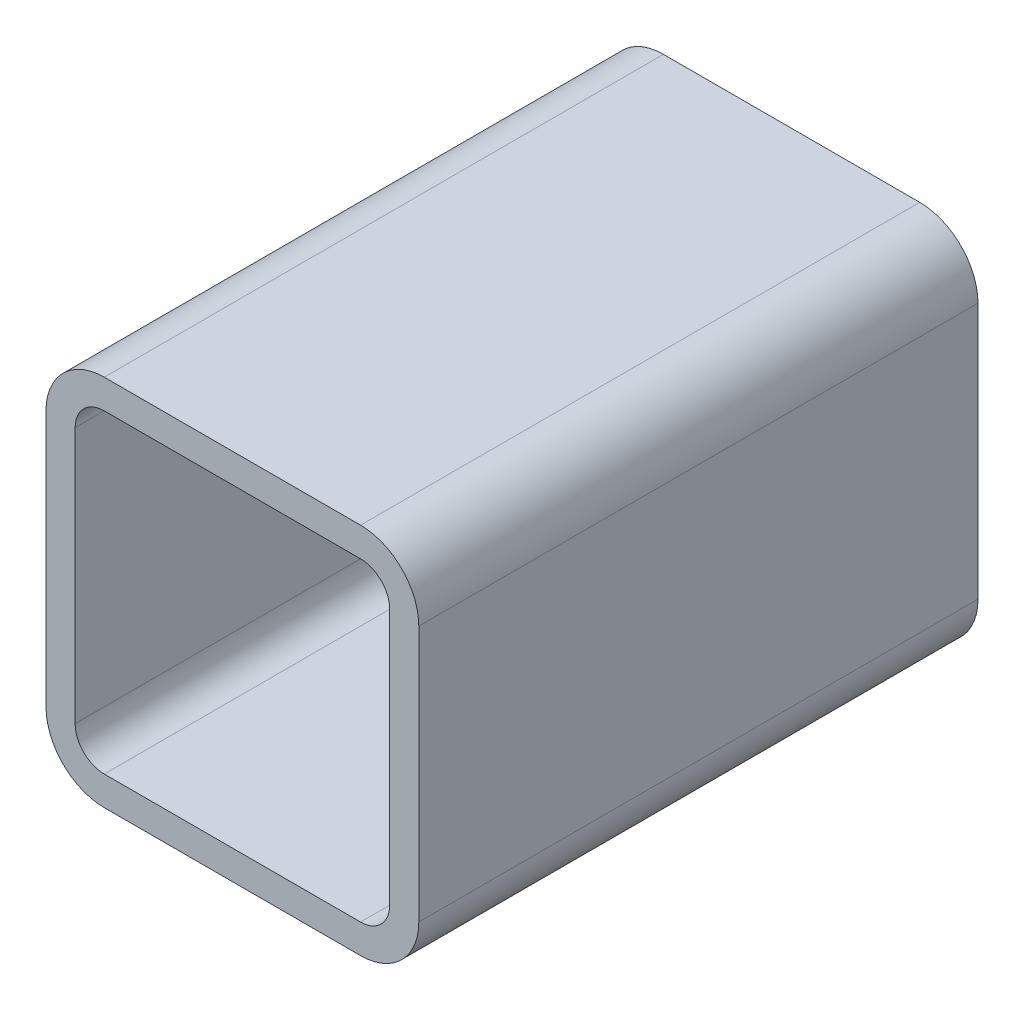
SolidWorks part; units mm, degrees
ref_plane "Front Plane" through (0, 0, 0) normal (0, 0, 1) x (1, 0, 0)
ref_plane "Top Plane" through (0, 0, 0) normal (0, 1, 0) x (1, 0, 0)
ref_plane "Right Plane" through (0, 0, 0) normal (1, 0, 0) x (0, 0, -1)
sketch "Sketch1" plane through (0, 0, 0) normal (0, 0, 1) x (1, 0, 0)
sketch_block_instance "HSS8x8x0.625-1"
sketch_block "HSS8x8x0.625"
extrude "Boss-Extrude1" add sketch "Sketch1" along normal blind 304.8
